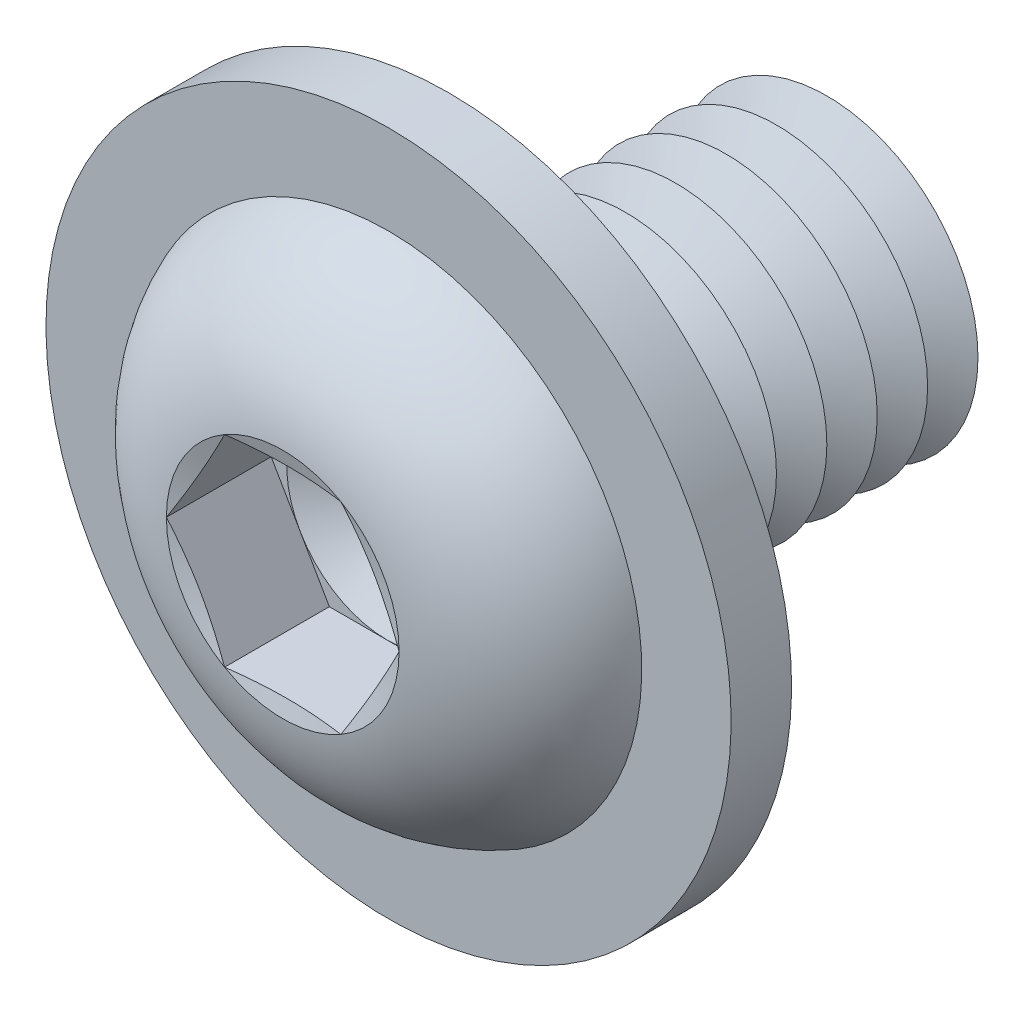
SolidWorks part; units mm, degrees
ref_plane "Front Plane" through (0, 0, 0) normal (0, 0, 1) x (1, 0, 0)
ref_plane "Top Plane" through (0, 0, 0) normal (0, 1, 0) x (1, 0, 0)
ref_plane "Right Plane" through (0, 0, 0) normal (1, 0, 0) x (0, 0, -1)
sketch "Sketch1" plane through (0, 0, 0) normal (1, 0, 0) x (0, 0, -1)
  line L0 (0, 3) -> (0, 5.25)
  line L3 (0, 3) -> (8, 3)
  line L4 (8, 3) -> (8, 0)
  line L5 (8, 0) -> (-3.3, 0) construction
  line L6 (-3.3, 0) -> (8, 0)
  line L7 (-3.3, 2.3094) -> (-3.3, 1.1547) construction
  line L8 (-3.3, 1.1547) -> (-3.3, 0)
  line L9 (-3.3, 2.3094) -> (-2.9906, 1.1547)
  line L10 (-2.9906, 1.1547) -> (-3.3, 1.1547)
  line L11 (8, 0) -> (22.7481, 0) construction
  line L12 (0, 5.25) -> (-3.3, 5.25) construction
  arc A1 (0, 5.25) -> (-3.3, 2.3094) centre (0, 1.928) ccw
  point P8 (8, 1.5)
  dimension "D1" = 10.5
  dimension "D2" = 6
  dimension "D3" = 3.3
  dimension "D4" = 4.6188
  dimension "D5" = 8
  dimension "D6" = 15
revolve "Revolve1" add sketch "Sketch1" angle 360 about L5
fillet "Fillet1" radius 0.5 1 edges at (-3, 0, 0)
sketch "Sketch2" plane through (0, 0, 0) normal (1, 0, 0) x (0, 0, -1)
  line L0 (7.5, 3) -> (8.5, 3)
  line L1 (8, 3) -> (0.5, 3) construction
  line L2 (8.5, 3) -> (8, 2.134)
  line L3 (8, -3) -> (8, 3) construction
  line L4 (8, 2.134) -> (7.5, 3)
  dimension "D1" = 1
revolve "Cut-Revolve1" cut sketch "Sketch2" angle 360 about axis through (0, 0, -8) along (0, 0, -1)
pattern_linear "LPattern1" count 8 spacing 1 along (0, 0, 1) of "Cut-Revolve1"
sketch "Sketch3" plane through (0, 0, 3.3) normal (0, 0, 1) x (1, 0, 0)
  line L7 (1.1547, 2) -> (-1.1547, 2)
  line L8 (-1.1547, 2) -> (-2.3094, 0)
  line L9 (-2.3094, 0) -> (-1.1547, -2)
  line L10 (-1.1547, -2) -> (1.1547, -2)
  line L11 (1.1547, -2) -> (2.3094, 0)
  line L12 (2.3094, 0) -> (1.1547, 2)
  circle A0 centre (0, 0) radius 2 construction
  circle A3 centre (0, 0) radius 2.3094 construction
extrude "Cut-Extrude1" cut sketch "Sketch3" against normal blind 2.08
sketch "Sketch4" plane through (0, 0, 1.22) normal (0, 0, 1) x (1, 0, 0)
  line L1 (1.1547, 2) -> (-1.1547, 2) construction
  circle A0 centre (0, 0) radius 2
extrude "Cut-Extrude2" cut sketch "Sketch4" against normal through all draft 60
sketch "Sketch5" plane through (0, 0, 0) normal (0, 0, -1) x (-1, 0, 0)
  circle A0 centre (0, 0) radius 6.8
  circle A1 centre (0, 0) radius 3.5
  circle A2 centre (0, 0) radius 3.5 construction
  dimension "D1" = 13.6
extrude "Boss-Extrude1" add sketch "Sketch5" against normal blind 1.2
